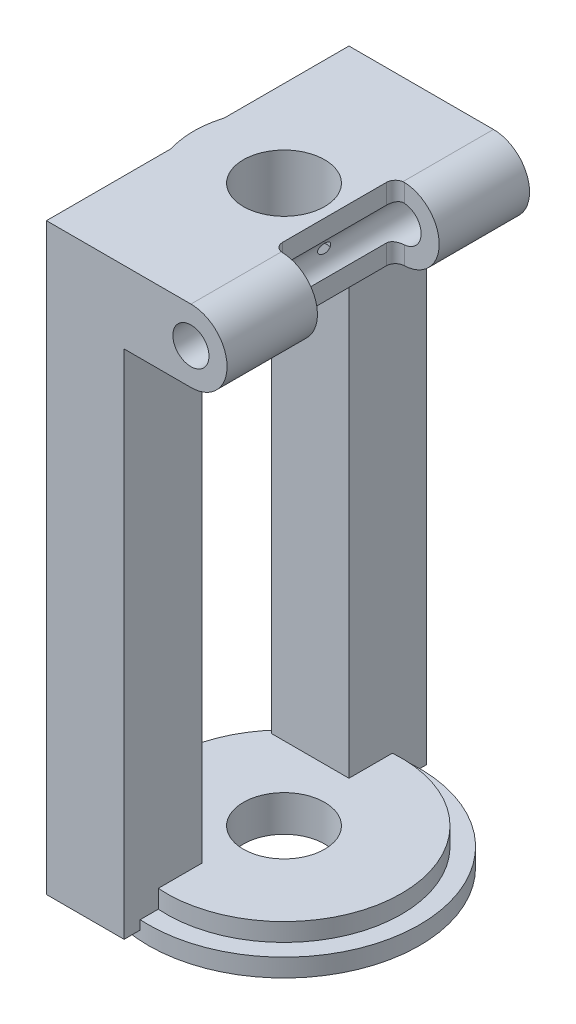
SolidWorks part; units mm, degrees
ref_plane "Front" through (0, 0, 0) normal (0, 0, 1) x (1, 0, 0)
ref_plane "Top" through (0, 0, 0) normal (0, 1, 0) x (1, 0, 0)
ref_plane "Side" through (0, 0, 0) normal (1, 0, 0) x (0, 0, -1)
sketch "Sketch1" plane through (0, 0, 0) normal (0, 0, 1) x (1, 0, 0)
  line L1 (18.4405, 110.6291) -> (2.4405, 110.6291)
  line L3 (18.4405, 118.6291) -> (2.4405, 118.6291)
  line L4 (2.4405, 110.6291) -> (2.4405, 118.6291)
  circle A0 centre (18.4405, 114.6291) radius 2 construction
  circle A1 centre (18.4405, 114.6291) radius 2
  arc A2 (18.4405, 110.6291) -> (18.4405, 118.6291) centre (18.4405, 114.6291) ccw
  dimension "D2" = 4
  dimension "D1" = 20
extrude "Base-Extrude" add sketch "Sketch1" along normal mid plane 33.5
sketch "Sketch2" plane through (0, 118.6291, 0) normal (0, 1, 0) x (-1, 0, 0)
  line L0 (-2.4405, 16.75) -> (-2.4405, -16.75) construction
  line L1 (-2.4405, 2.9353) -> (-2.4405, -2.9353)
  circle A3 centre (-12, 0) radius 10
  arc A4 (-2.4405, -2.9353) -> (-2.4405, 2.9353) centre (-12, 0) ccw
  dimension "D1" = 6
extrude "Boss-Extrude1" add sketch "Sketch2" against normal up to vertex
sketch "Sketch3" plane through (0, 110.6291, 0) normal (0, -1, 0) x (1, 0, 0)
  line L0 (0, 0) -> (22.3652, 0) construction
  line L1 (11.0405, -16.75) -> (11.0405, -8.15)
  line L2 (2.4405, 16.75) -> (11.0405, 16.75)
  line L3 (2.4405, 16.75) -> (2.4405, 8.15)
  line L4 (2.4405, 8.15) -> (11.0405, 8.15)
  line L5 (11.0405, 16.75) -> (11.0405, 8.15)
  line L6 (2.4405, -8.15) -> (11.0405, -8.15)
  line L7 (2.4405, -16.75) -> (2.4405, -8.15)
  line L8 (2.4405, -16.75) -> (11.0405, -16.75)
  dimension "D1" = 8.6
extrude "Boss-Extrude2" add sketch "Sketch3" along normal offset from surface (56.6291 mm away) 1
sketch "Sketch5" plane through (0, 0, 0) normal (0, 0, 1) x (1, 0, 0)
  line L0 (12, 112.4766) -> (12, 53) construction
  line L1 (12, 110.6291) -> (12, 118.6291) construction
  line L2 (12, 57) -> (-1, 57)
  line L3 (-1, 57) -> (-1, 55)
  line L4 (-1, 55) -> (-3, 55)
  line L5 (-3, 55) -> (-3, 53)
  line L6 (-3, 53) -> (12, 53)
  line L7 (12, 53) -> (12, 57)
  dimension "D1" = 2
  dimension "D2" = 30
  dimension "D3" = 1
  dimension "D4" = 4
  dimension "D5" = 2
revolve "Boss-Revolve1" add sketch "Sketch5" angle 360 about L0
sketch "Sketch4" plane through (0, 118.6291, 0) normal (0, 1, 0) x (-1, 0, 0)
  circle A2 centre (-12, 0) radius 4.5
  circle A3 centre (-12, 0) radius 4.5
  dimension "D1" = 0.5
extrude "Cut-Extrude1" cut sketch "Sketch4" against normal through all
sketch "Sketch6" plane through (0, 118.6291, 0) normal (0, 1, 0) x (-1, 0, 0)
  line L0 (0, 0) -> (-28.0424, 0) construction
  line L1 (-22.4405, 16.75) -> (-22.4405, -16.75) construction
  line L2 (-22.4405, 6.7435) -> (-22.4405, -6.7435)
  line L3 (-22.4405, 6.7435) -> (-17.5934, 6.7435)
  line L4 (-18.4405, 16.75) -> (-18.4405, -16.75) construction
  line L5 (-17.5934, 6.7435) -> (-17.5934, -6.7435)
  line L6 (-22.4405, -6.7435) -> (-17.5934, -6.7435)
  point P11 (-18.4405, 0)
extrude "Cut-Extrude2" cut sketch "Sketch6" against normal up to vertex
fillet "Fillet1" radius 1
